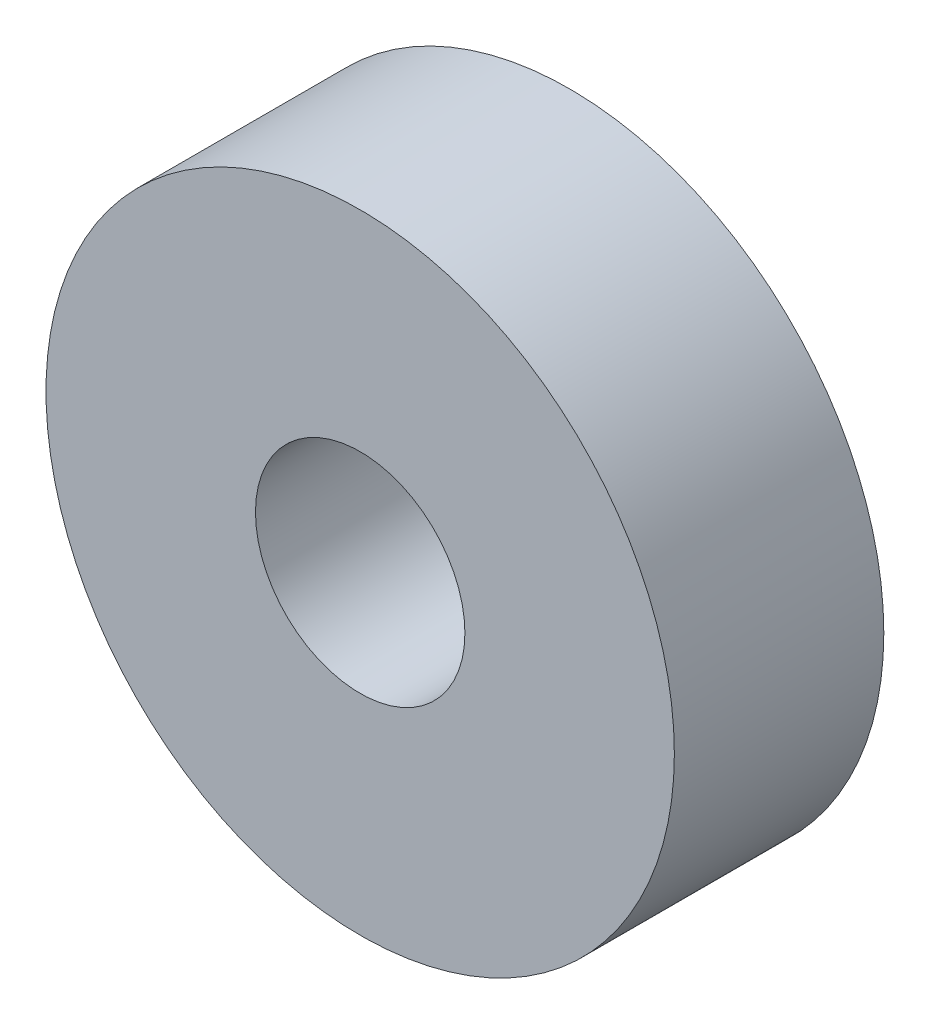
SolidWorks part; units mm, degrees
ref_plane "正面" through (0, 0, 0) normal (0, 0, 1) x (1, 0, 0)
ref_plane "平面" through (0, 0, 0) normal (0, 1, 0) x (1, 0, 0)
ref_plane "右側面" through (0, 0, 0) normal (1, 0, 0) x (0, 0, -1)
sketch "ｽｹｯﾁ1" plane through (0, 0, 0) normal (0, 0, 1) x (1, 0, 0)
  circle A0 centre (0, 0) radius 6
  dimension "D1" = 12
extrude "押し出し1" add sketch "ｽｹｯﾁ1" along normal blind 4
sketch "ｽｹｯﾁ2" plane through (0, 0, 0) normal (0, 0, 1) x (1, 0, 0)
  circle A0 centre (0, 0) radius 2
  dimension "D1" = 4
extrude "押し出し2" cut sketch "ｽｹｯﾁ2" along normal through all
